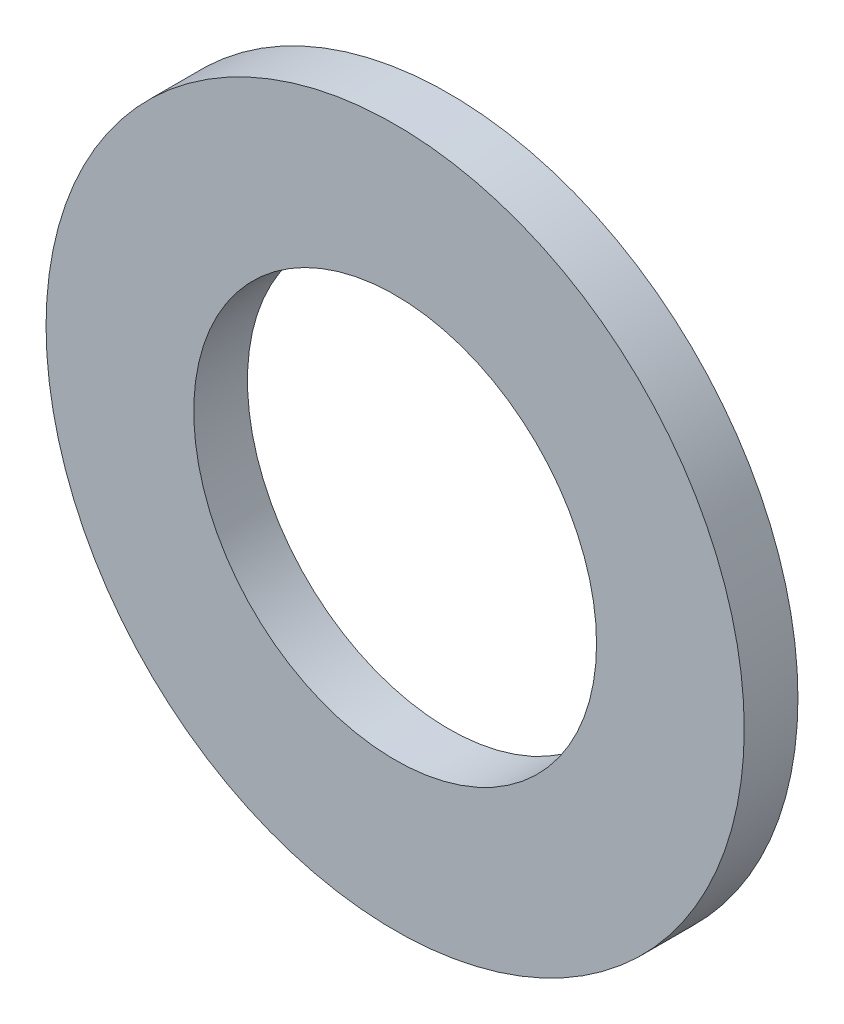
SolidWorks part; units mm, degrees
ref_plane "Plan de face" through (0, 0, 0) normal (0, 0, 1) x (1, 0, 0)
ref_plane "Plan de dessus" through (0, 0, 0) normal (0, 1, 0) x (1, 0, 0)
ref_plane "Plan de droite" through (0, 0, 0) normal (1, 0, 0) x (0, 0, -1)
sketch "Esquisse1" plane through (0, 0, 0) normal (0, 0, 1) x (1, 0, 0)
  circle A0 centre (0, 0) radius 15
  circle A1 centre (0, 0) radius 26
  dimension "D1" = 30
  dimension "D2" = 52
extrude "Extrusion1" add sketch "Esquisse1" along normal blind 4
